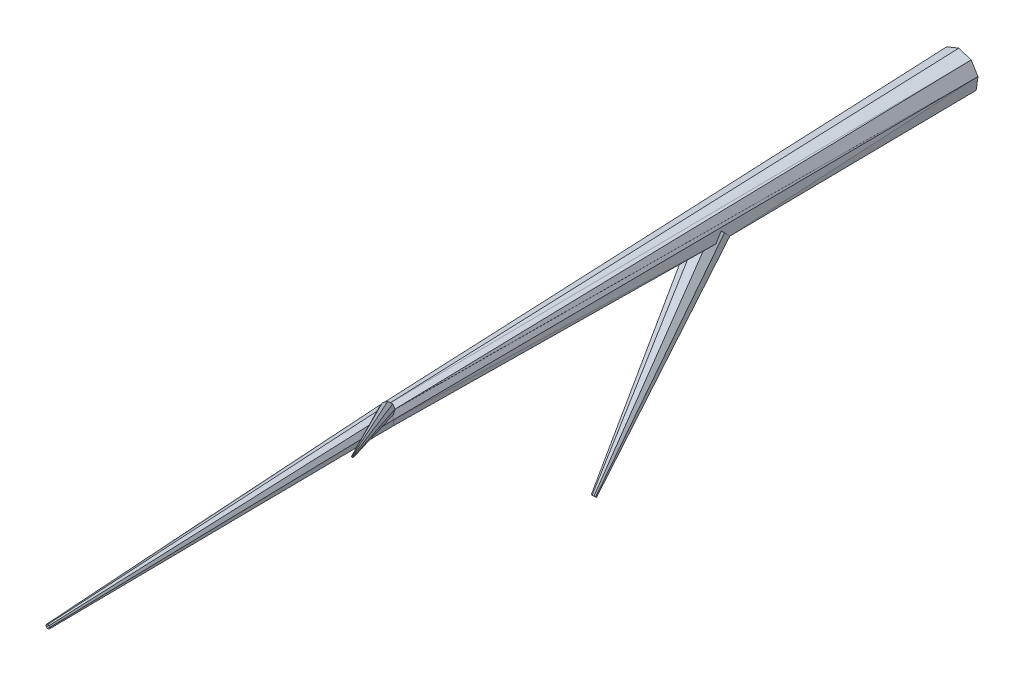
SolidWorks part; units mm, degrees
ref_plane "Front Plane" through (0, 0, 0) normal (0, 0, 1) x (1, 0, 0)
ref_plane "Top Plane" through (0, 0, 0) normal (0, 1, 0) x (1, 0, 0)
ref_plane "Right Plane" through (0, 0, 0) normal (1, 0, 0) x (0, 0, -1)
sketch3d "3DSketch1"
  point P0 (-161.8918, 166.2026, -702.2015)
sketch3d "3DSketch2"
  line L0 (-198.1465, 110.9499, -1432.6222) -> (-206.4755, 150.6165, -1432.6222)
  line L1 (-206.4755, 150.6165, -1432.6222) -> (-187.3587, 186.3565, -1432.6222)
  line L2 (-187.3587, 186.3565, -1432.6222) -> (-169.7211, 120.0364, 358.1656)
  line L3 (-169.7211, 120.0364, 358.1656) -> (-178.7343, 103.1856, 358.1656)
  line L4 (-178.7343, 103.1856, 358.1656) -> (-174.8073, 84.4836, 358.1656)
  line L5 (-174.8073, 84.4836, 358.1656) -> (-198.1465, 110.9499, -1432.6222)
surface "Surface-Loft1"
sketch3d "3DSketch3"
  point P0 (-140.6778, 73.3009, 358.1656)
sketch3d "3DSketch4"
  line L0 (-101.6952, 98.4683, -669.1666) -> (-95.5711, 114.2782, -1432.6222)
  line L1 (-95.5711, 114.2782, -1432.6222) -> (-125.7588, 87.2318, -1432.6222)
  line L2 (-125.7588, 87.2318, -1432.6222) -> (-166.269, 85.9174, -1432.6222)
  line L3 (-166.269, 85.9174, -1432.6222) -> (-159.7777, 72.6812, 358.1656)
  line L4 (-159.7777, 72.6812, 358.1656) -> (-131.958, 72.6812, 1432.6222)
  line L5 (-131.958, 72.6812, 1432.6222) -> (-127.6019, 72.8226, 1432.6222)
  line L6 (-127.6019, 72.8226, 1432.6222) -> (-124.3558, 75.7309, 1432.6222)
  line L7 (-124.3558, 75.7309, 1432.6222) -> (-126.4449, 86.0528, 358.1656)
  line L8 (-126.4449, 86.0528, 358.1656) -> (-115.6475, 91.4692, -90.0201)
  line L9 (-115.6475, 91.4692, -90.0201) -> (-101.6952, 98.4683, -669.1666)
surface "Surface-Loft2"
sketch3d "3DSketch5"
  point P0 (-151.9851, 127.1513, 358.1656)
sketch3d "3DSketch6"
  line L0 (-133.8252, 121.2011, 358.1656) -> (-126.039, 83.7472, 1432.6222)
  line L1 (-126.039, 83.7472, 1432.6222) -> (-130.1807, 85.1042, 1432.6222)
  line L2 (-130.1807, 85.1042, 1432.6222) -> (-169.7211, 120.0364, 358.1656)
  line L3 (-169.7211, 120.0364, 358.1656) -> (-187.3587, 186.3565, -1432.6222)
  line L4 (-187.3587, 186.3565, -1432.6222) -> (-149.7411, 201.447, -1432.6222)
  line L5 (-149.7411, 201.447, -1432.6222) -> (-111.2244, 188.8268, -1432.6222)
  line L6 (-111.2244, 188.8268, -1432.6222) -> (-133.5922, 121.7874, 344.7957)
  line L7 (-133.5922, 121.7874, 344.7957) -> (-133.8252, 121.2011, 358.1656)
surface "Surface-Loft3"
sketch3d "3DSketch7"
  point P0 (-154.954, 95.9711, 946.4712)
sketch3d "3DSketch8"
  line L0 (-178.7343, 103.1856, 358.1656) -> (-169.7211, 120.0364, 358.1656)
  line L1 (-169.7211, 120.0364, 358.1656) -> (-130.1807, 85.1042, 1432.6222)
  line L2 (-130.1807, 85.1042, 1432.6222) -> (-134.2258, 83.4815, 1432.6222)
  line L3 (-134.2258, 83.4815, 1432.6222) -> (-136.2814, 79.6384, 1432.6222)
  line L4 (-136.2814, 79.6384, 1432.6222) -> (-178.7343, 103.1856, 358.1656)
surface "Surface-Loft4"
sketch3d "3DSketch9"
  point P0 (-89.831, 154.4012, -1432.6222)
sketch3d "3DSketch10"
  line L0 (-95.5711, 114.2782, -1432.6222) -> (-101.6952, 98.4683, -669.1666)
  line L1 (-101.6952, 98.4683, -669.1666) -> (-123.7386, 104.9701, 358.1656)
  line L2 (-123.7386, 104.9701, 358.1656) -> (-133.8252, 121.2011, 358.1656)
surface "Surface-Loft5"
sketch3d "3DSketch11"
  line L0 (202.7267, 396.2995, 816.8249) -> (202.0171, 397.8978, 816.3555)
  line L1 (202.0171, 397.8978, 816.3555) -> (202.3594, 399.2887, 815.2842)
  line L2 (202.3594, 399.2887, 815.2842) -> (203.5935, 399.8213, 814.1121)
  line L3 (203.5935, 399.8213, 814.1121) -> (205.1419, 399.2464, 813.3878)
  line L4 (205.1419, 399.2464, 813.3878) -> (206.2801, 397.8331, 813.4502)
  line L5 (206.2801, 397.8331, 813.4502) -> (206.4755, 396.2426, 814.27)
  line L6 (206.4755, 396.2426, 814.27) -> (205.6367, 395.2192, 815.4637)
  line L7 (205.6367, 395.2192, 815.4637) -> (204.1562, 395.2417, 816.4728)
  line L8 (204.1562, 395.2417, 816.4728) -> (202.7267, 396.2995, 816.8249)
sketch3d "3DSketch12"
  line L0 (-158.0727, 111.2221, 368.0455) -> (-162.9614, 122.2332, 364.8116)
  line L1 (-162.9614, 122.2332, 364.8116) -> (-160.6029, 131.8153, 357.4304)
  line L2 (-160.6029, 131.8153, 357.4304) -> (-152.1009, 135.4846, 349.3558)
  line L3 (-152.1009, 135.4846, 349.3558) -> (-141.4336, 131.5243, 344.366)
  line L4 (-141.4336, 131.5243, 344.366) -> (-133.5922, 121.7874, 344.7957)
  line L5 (-133.5922, 121.7874, 344.7957) -> (-132.246, 110.83, 350.4438)
  line L6 (-132.246, 110.83, 350.4438) -> (-138.0247, 103.7791, 358.6677)
  line L7 (-138.0247, 103.7791, 358.6677) -> (-148.2245, 103.9339, 365.6191)
  line L8 (-148.2245, 103.9339, 365.6191) -> (-158.0727, 111.2221, 368.0455)
surface "Surface-Loft6"
sketch3d "3DSketch13"
  line L0 (-111.2966, -395.0405, -246.6648) -> (-109.3117, -392.058, -243.8893)
  line L1 (-109.3117, -392.058, -243.8893) -> (-105.1268, -390.5546, -242.7455)
  line L2 (-105.1268, -390.5546, -242.7455) -> (-100.7001, -391.2337, -243.7686)
  line L3 (-100.7001, -391.2337, -243.7686) -> (-98.1028, -393.7775, -246.4799)
  line L4 (-98.1028, -393.7775, -246.4799) -> (-98.5503, -396.9958, -249.6106)
  line L5 (-98.5503, -396.9958, -249.6106) -> (-101.8331, -399.3826, -251.696)
  line L6 (-101.8331, -399.3826, -251.696) -> (-106.4153, -399.8213, -251.7602)
  line L7 (-106.4153, -399.8213, -251.7602) -> (-110.1527, -398.1064, -249.7732)
  line L8 (-110.1527, -398.1064, -249.7732) -> (-111.2966, -395.0405, -246.6648)
sketch3d "3DSketch14"
  line L0 (-181.3596, 110.6891, -650.7551) -> (-168.9542, 129.3292, -633.4086)
  line L1 (-168.9542, 129.3292, -633.4086) -> (-142.7987, 138.7255, -626.2599)
  line L2 (-142.7987, 138.7255, -626.2599) -> (-115.1316, 134.4813, -632.6542)
  line L3 (-115.1316, 134.4813, -632.6542) -> (-98.8985, 118.5825, -649.5994)
  line L4 (-98.8985, 118.5825, -649.5994) -> (-101.6952, 98.4683, -669.1666)
  line L5 (-101.6952, 98.4683, -669.1666) -> (-122.213, 83.5505, -682.2003)
  line L6 (-122.213, 83.5505, -682.2003) -> (-150.8514, 80.8091, -682.6016)
  line L7 (-150.8514, 80.8091, -682.6016) -> (-174.2102, 91.527, -670.183)
  line L8 (-174.2102, 91.527, -670.183) -> (-181.3596, 110.6891, -650.7551)
surface "Surface-Loft7"
sketch3d "3DSketch15"
  spline S0 degree 2 poles (-166.269, 85.9174, -1432.6222) (-181.0061, 68.7092, 0.4315) (-131.958, 72.6812, 1432.6222) knots 0 0 0 1 1 1
sketch3d "3DSketch16"
  spline S0 degree 2 poles (-198.1465, 110.9499, -1432.6222) (-200.6369, 84.1281, 0.7369) (-135.3858, 75.373, 1432.6222) knots 0 0 0 1 1 1
surface "Surface-Loft8"
sketch3d "3DSketch17"
  line L0 (-126.4449, 86.0528, 358.1656) -> (-123.7386, 104.9701, 358.1656)
  line L1 (-123.7386, 104.9701, 358.1656) -> (-133.8252, 121.2011, 358.1656)
sketch3d "3DSketch18"
  line L0 (-124.3558, 75.7309, 1432.6222) -> (-123.7386, 80.0453, 1432.6222)
  line L1 (-123.7386, 80.0453, 1432.6222) -> (-126.039, 83.7472, 1432.6222)
surface "Surface-Loft9"
ref_plane "Plane1" through (-162.2212, -34.0624, 5.663) normal (0.9781, 0.2054, -0.0341) x (-0.0334, -0.007, -0.9994)
sketch "Sketch1" plane through (-162.2212, -34.0624, 5.663) normal (0.9781, 0.2054, -0.0341) x (-0.0334, -0.007, -0.9994)
  line L0 (-352.7082, 137.7123) -> (-1427.7917, 105.9437)
  line L1 (-1427.7917, 105.9437) -> (-1427.7917, 101.5853)
  line L2 (-1427.7917, 101.5853) -> (-352.7082, 118.6024)
  line L3 (-352.7082, 118.6024) -> (-352.7082, 137.7123)
surface "Surface-Plane1" sketch "Sketch1"
ref_plane "Plane2" through (-128.0613, 18.3207, -2.8637) normal (-0.9897, 0.1416, -0.0221) x (-0.0219, 0.0031, 0.9998)
sketch "Sketch2" plane through (-128.0613, 18.3207, -2.8637) normal (-0.9897, 0.1416, -0.0221) x (-0.0219, 0.0031, 0.9998)
  line L0 (361.1178, 67.2784) -> (361.1178, 86.3882)
  line L1 (361.1178, 86.3882) -> (-666.4661, 83.0738)
  line L2 (-666.4661, 83.0738) -> (-87.1777, 74.1693)
  line L3 (-87.1777, 74.1693) -> (361.1178, 67.2784)
surface "Surface-Plane2" sketch "Sketch2"
ref_plane "Plane3" through (-32.7847, -20.3736, -1.181) normal (-0.849, -0.5276, -0.0306) x (-0.026, -0.0161, 0.9995)
sketch "Sketch3" plane through (-32.7847, -20.3736, -1.181) normal (-0.849, -0.5276, -0.0306) x (-0.026, -0.0161, 0.9995)
  line L0 (-1432.111, 178.5562) -> (346.1386, 173.9537)
  line L1 (346.1386, 173.9537) -> (-1432.111, 219.0877)
  line L2 (-1432.111, 219.0877) -> (-1432.111, 178.5562)
surface "Surface-Plane3" sketch "Sketch3"
